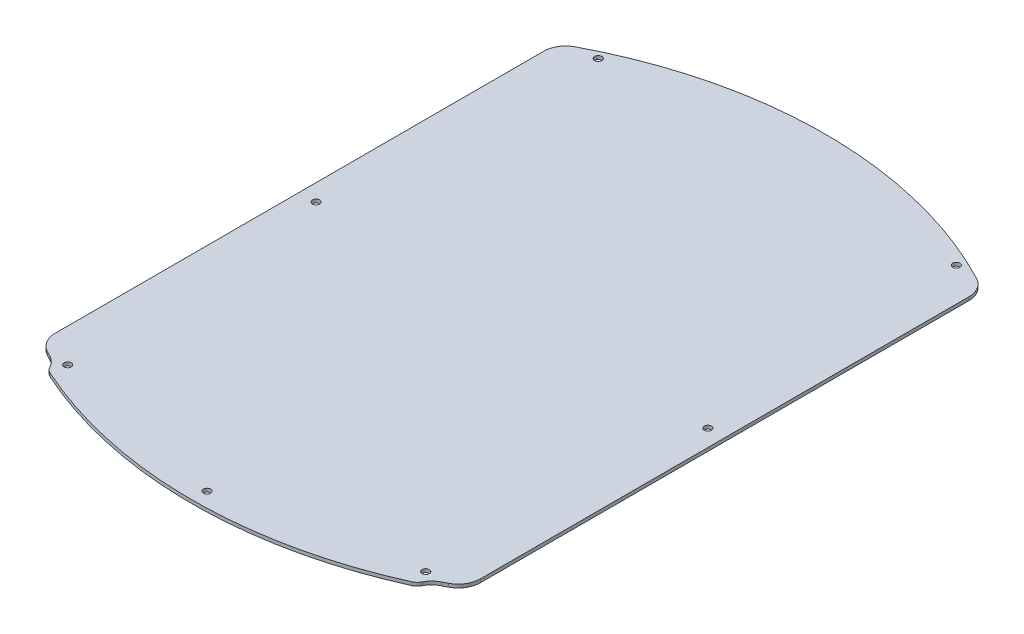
SolidWorks part; units mm, degrees
ref_plane "Front Plane" through (0, 0, 0) normal (0, 0, 1) x (1, 0, 0)
ref_plane "Top Plane" through (0, 0, 0) normal (0, 1, 0) x (1, 0, 0)
ref_plane "Right Plane" through (0, 0, 0) normal (1, 0, 0) x (0, 0, -1)
sketch "Sketch1" plane through (0, 0, 0) normal (0, 1, 0) x (1, 0, 0)
  line L0 (0, -140) -> (0, -115) construction
  line L1 (95, -115) -> (-95, -115) construction
  line L2 (95, -115) -> (95, 115)
  line L3 (95, 115) -> (-95, 115) construction
  line L4 (-95, -115) -> (-95, 115)
  line L5 (95, -115) -> (-95, 115) construction
  line L6 (95, 115) -> (-95, -115) construction
  line L7 (0, 140) -> (0, 115) construction
  arc A0 (-95, -115) -> (95, -115) centre (0, 53) ccw
  arc A1 (-95, 115) -> (95, 115) centre (0, -53) cw
  point P0 (0, 0)
  dimension "D3" = 25
  dimension "D1" = 190
  dimension "D2" = 230
base flange "Base-Flange1" sketch "Sketch1" thickness 1.5 reverse thickness direction no parameters "D1"=2
sketch "Sketch2" plane through (0, 0, 0) normal (0, 1, 0) x (1, 0, 0)
  line L0 (-82.5, -124.7913) -> (-82.5, -121.4785)
  line L9 (82.5, -124.7913) -> (82.5, -121.4785)
  arc A0 (-95, -115) -> (95, -115) centre (0, 53) ccw construction
  arc A5 (-82.5, -121.4785) -> (82.5, -121.4785) centre (0, 53) ccw
  arc A8 (-96.4767, -117.6114) -> (96.4767, -117.6114) centre (0, 53) ccw
  arc A9 (-82.5, -124.7913) -> (82.5, -124.7913) centre (0, 53) ccw
  point P7 (0, -140)
  dimension "D2" = 165
  dimension "D1" = 3
base flange "Tab1" sketch "Sketch2" thickness 1.5 reverse thickness direction no parameters "D1"=2
fillet "Fillet1" radius 10 6 edges at (-95, -0.75, 115) (95, -0.75, 115) (-82.5, -0.75, 121.4785) (82.5, -0.75, 121.4785) (-95, -0.75, -115) (95, -0.75, -115)
fillet "Fillet2" radius 5 2 edges at (82.5, -0.75, 124.7913) (-82.5, -0.75, 124.7913)
sketch "Sketch9" plane through (0, 0, 0) normal (0, 1, 0) x (1, 0, 0)
  circle A0 centre (-79.9805, 118.5187) radius 1.6 construction
  circle A1 centre (-79.9805, 118.5187) radius 1.6
  circle A2 centre (79.9805, 118.5187) radius 1.6 construction
  circle A3 centre (79.9805, 118.5187) radius 1.6
  circle A4 centre (87.5, 0) radius 1.25 construction
  circle A5 centre (87.5, 0) radius 1.25 construction
  circle A6 centre (-87.5, 0) radius 1.25 construction
  circle A7 centre (-87.5, 0) radius 1.25 construction
  circle A8 centre (-79.9805, -118.5187) radius 1.6 construction
  circle A9 centre (-79.9805, -118.5187) radius 1.6
  circle A10 centre (0, -136.25) radius 1.6 construction
  circle A11 centre (0, -136.25) radius 1.6
  circle A12 centre (79.9805, -118.5187) radius 1.6 construction
  circle A13 centre (79.9805, -118.5187) radius 1.6
  circle A14 centre (87.5, 0) radius 1.6
  circle A15 centre (-87.5, 0) radius 1.6
  dimension "D1" = 3.2
extrude "Cut-Extrude1" cut sketch "Sketch9" against normal through all
sketch "Bend-Lines1" [suppressed] plane through (0, 0, 0) normal (0, 1, 0) x (1, 0, 0)
sketch "Bounding-Box1" [suppressed] plane through (0, 0, 0) normal (0, 1, 0) x (1, 0, 0)
sheet metal parameters "Sheet-Metal1" thickness 1.5 parameters "D1"=2
flat pattern "Flat-Pattern1"
sketch "Bend-Lines2" plane through (0, 0, 0) normal (0, 1, 0) x (1, 0, 0)
sketch3d "Bounding-Box2" [suppressed]
  line L0 (-95, 64.375, 0) -> (-95, -235.625, 0) construction
  line L1 (95, 64.375, 0) -> (95, -235.625, 0) construction
  line L2 (-95, 64.375, 0) -> (95, 64.375, 0) construction
  line L3 (-95, -235.625, 0) -> (95, -235.625, 0) construction
sheet metal parameters "Sheet-Metal2" thickness 1.5 parameters "D1"=2
flat pattern "Flat-Pattern2"
sketch "Bend-Lines3" plane through (0, 0, 0) normal (0, 1, 0) x (1, 0, 0)
sketch3d "Bounding-Box3" [suppressed]
  line L0 (-95, -90, 0) -> (-95, 193, 0) construction
  line L1 (95, -90, 0) -> (95, 193, 0) construction
  line L2 (-95, -90, 0) -> (95, -90, 0) construction
  line L3 (-95, 193, 0) -> (95, 193, 0) construction
sheet metal parameters "Sheet-Metal7" thickness 1.5 parameters "D1"=2
flat pattern "Flat-Pattern2"
sketch "Bend-Lines3" plane through (0, 0, 0) normal (0, 1, 0) x (1, 0, 0)
sketch3d "Bounding-Box3" [suppressed]
  line L0 (-95, -90, 0) -> (-95, 193, 0) construction
  line L1 (95, -90, 0) -> (95, 193, 0) construction
  line L2 (-95, -90, 0) -> (95, -90, 0) construction
  line L3 (-95, 193, 0) -> (95, 193, 0) construction
